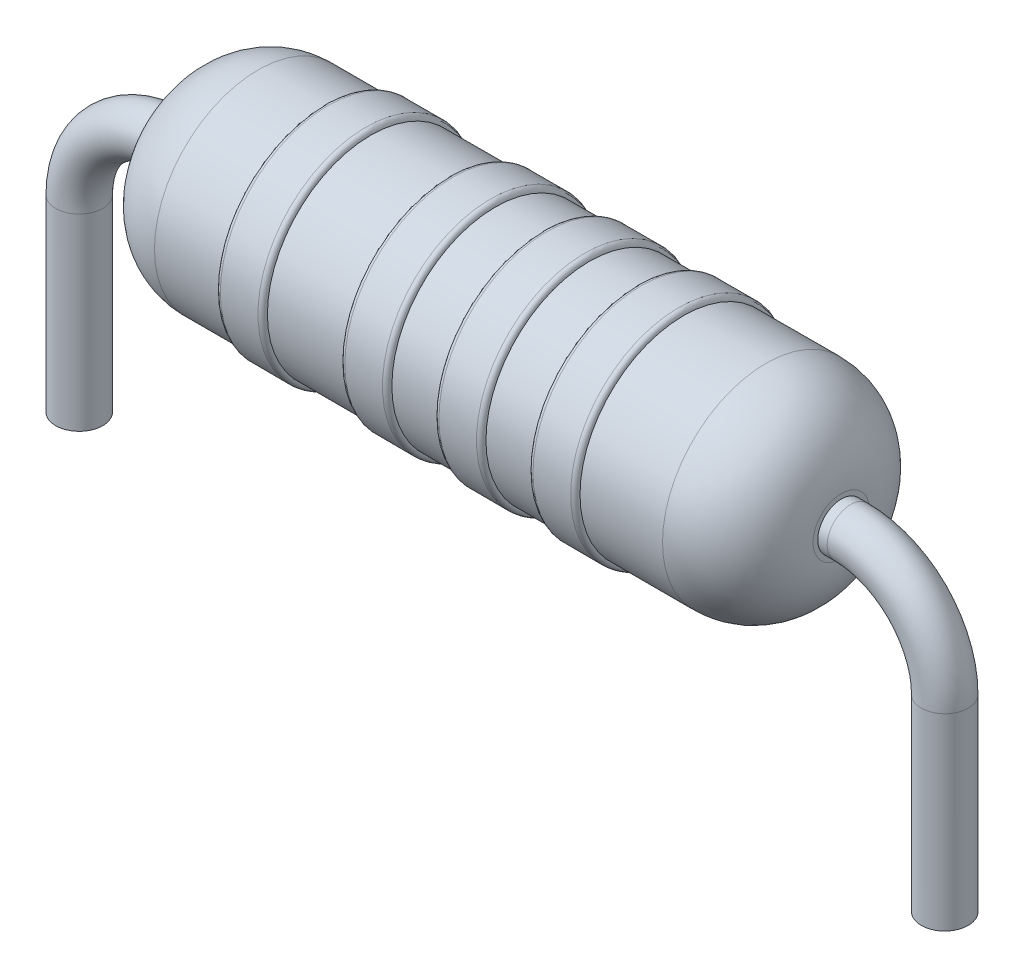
SolidWorks part; units mm, degrees
ref_plane "Face" through (0, 0, 0) normal (0, 0, 1) x (1, 0, 0)
ref_plane "Dessus" through (0, 0, 0) normal (0, 1, 0) x (1, 0, 0)
ref_plane "Droite" through (0, 0, 0) normal (1, 0, 0) x (0, 0, -1)
sketch "Esquisse1" plane through (0, 0, 0) normal (0, 0, 1) x (1, 0, 0)
  line L0 (-54.2687, 0) -> (62.1733, 0) construction
  line L1 (-48.4922, 1.1) -> (45.7559, 1.1) construction
  line L2 (-3.5, -1.6411) -> (-3.5, 4.3175) construction
  line L3 (0, -1.0268) -> (0, 4.1947) construction
  line L4 (3.5, 3.6009) -> (3.5, -1.9687) construction
  line L5 (-3.5, 0) -> (-3.5, 0.3)
  line L6 (-2.7, 1.1) -> (2.7, 1.1)
  line L7 (3.5, 0.3) -> (3.5, 0)
  line L8 (3.5, 0) -> (-3.5, 0)
  arc A0 (-2.7, 1.1) -> (-3.5, 0.3) centre (-2.7, 0.3) ccw
  arc A1 (3.5, 0.3) -> (2.7, 1.1) centre (2.7, 0.3) ccw
revolve "Base-Révolution" add sketch "Esquisse1" angle 360 about L0
sketch "Esquisse2" plane through (0, 0, 0) normal (0, 0, 1) x (1, 0, 0)
  line L0 (-3.3896, 1.15) -> (3.161, 1.15) construction
  line L1 (-2, 1.3889) -> (-2, -0.1179) construction
  line L2 (-1.5, 1.4925) -> (-1.5, -0.2136) construction
  line L3 (4.3262, 0) -> (-3.8651, 0) construction
  line L4 (1.323, 0) -> (1.823, 0)
  line L5 (0.323, 0) -> (0.823, 0)
  line L6 (-0.677, 1.15) -> (-0.677, 0)
  line L7 (0.323, 1.15) -> (0.323, 0)
  line L8 (1.323, 1.15) -> (1.323, 0)
  line L9 (-0.177, 1.15) -> (-0.177, 0)
  line L10 (0.823, 1.15) -> (0.823, 0)
  line L11 (1.823, 1.15) -> (1.823, 0)
  line L12 (-0.677, 0) -> (-0.177, 0)
  line L13 (-0.677, 1.15) -> (-0.177, 1.15)
  line L14 (0.323, 1.15) -> (0.823, 1.15)
  line L15 (1.323, 1.15) -> (1.823, 1.15)
  line L16 (-2, 1.15) -> (-1.5, 1.15)
  line L17 (-1.5, 1.15) -> (-1.5, 0)
  line L18 (-1.5, 0) -> (-2, 0)
  line L19 (-2, 0) -> (-2, 1.15)
revolve "Boss.-Révol.1" add sketch "Esquisse2" angle 360 about L3
fillet "Congé1" radius 0.05 8 edges at (-0.177, 0, -1.15) (-0.677, 0, -1.15) (0.823, 0, -1.15) (0.323, 0, -1.15) (1.823, 0, -1.15) (1.323, 0, -1.15) (-1.5, 0, -1.15) (-2, 0, -1.15)
sketch "Esquisse3" plane through (-3.5, 0, 0) normal (-1, 0, 0) x (0, 0, 1)
  circle A0 centre (0, 0) radius 0.25
sketch "Esquisse4" plane through (0, 0, 0) normal (0, 0, 1) x (1, 0, 0)
  line L0 (-3.1075, 0) -> (-5.8186, 0) construction
  line L1 (0, -2.524) -> (0, 3.2043) construction
  line L2 (-5.9326, -3) -> (3.6667, -3) construction
  line L3 (-4.6, 1.6795) -> (-4.6, -3.4934) construction
  line L4 (-3.02, 0) -> (-3.6, 0)
  line L5 (-4.6, -1) -> (-4.6, -3)
  arc A0 (-4.6, -1) -> (-3.6, 0) centre (-3.6, -1) cw
  dimension "D1" = 3
  dimension "D2" = 4.6
sweep "Balayage1" add profiles "Esquisse3" path "Esquisse4"
ref_plane "Plan1" through (0, 0, 0) normal (1, 0, 0) x (0, 0, -1)
mirror "Symétrie1" about plane through (0, 0, 0) normal (1, 0, 0) of "Balayage1"
